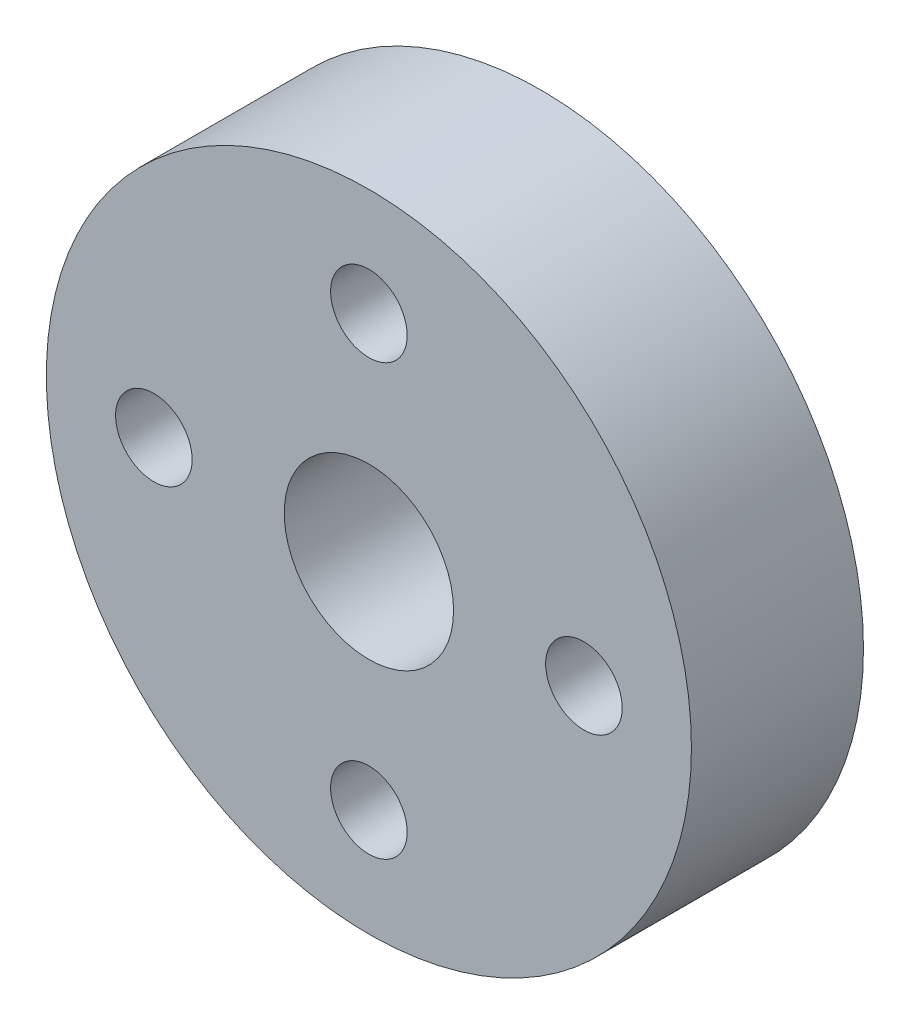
SolidWorks part; units mm, degrees
ref_plane "Front Plane" through (0, 0, 0) normal (0, 0, 1) x (1, 0, 0)
ref_plane "Top Plane" through (0, 0, 0) normal (0, 1, 0) x (1, 0, 0)
ref_plane "Right Plane" through (0, 0, 0) normal (1, 0, 0) x (0, 0, -1)
sketch "Sketch1" plane through (0, 0, 0) normal (0, 0, 1) x (1, 0, 0)
  circle A0 centre (0, 0) radius 2.5
  circle A1 centre (0, 0) radius 9.525
  dimension "D1" = 5
  dimension "D2" = 19.05
extrude "Boss-Extrude1" add sketch "Sketch1" along normal blind 5.08
sketch "Sketch2" plane through (0, 0, 5.08) normal (0, 0, 1) x (1, 0, 0)
  point P0 (-6.35, 0)
  point P1 (6.35, 0)
  point P2 (0, 6.35)
  point P4 (0, -6.35)
  dimension "D1" = 6.35
  dimension "D2" = 6.35
  dimension "D3" = 6.35
  dimension "D4" = 6.35
hole_wizard "Tap Drill for #4-40 Tap1" positions "Sketch4" profile "Sketch3" hole size "#4-40" standard "ANSI Inch"
sketch "Sketch4" plane through (0, 0, 5.08) normal (0, 0, 1) x (1, 0, 0)
  point P0 (0, 6.35)
  point P3 (6.35, 0)
  point P6 (0, -6.35)
  point P9 (-6.35, 0)
sketch "Sketch3" plane through (0, 6.35, 5.08) normal (1, 0, 0) x (0, -1, 0)
  line L0 (0, 0) -> (0, 5.08)
  line L1 (0, 5.08) -> (1.1303, 5.08)
  line L2 (1.1303, 5.08) -> (1.1303, 0)
  line L5 (1.1303, 0) -> (0, 0)
  line L11 (0, -6.35) -> (0, 107.95) construction
  dimension "Thru Hole Dia." = 2.2606
  dimension "Thru Hole Depth" = 5.08
